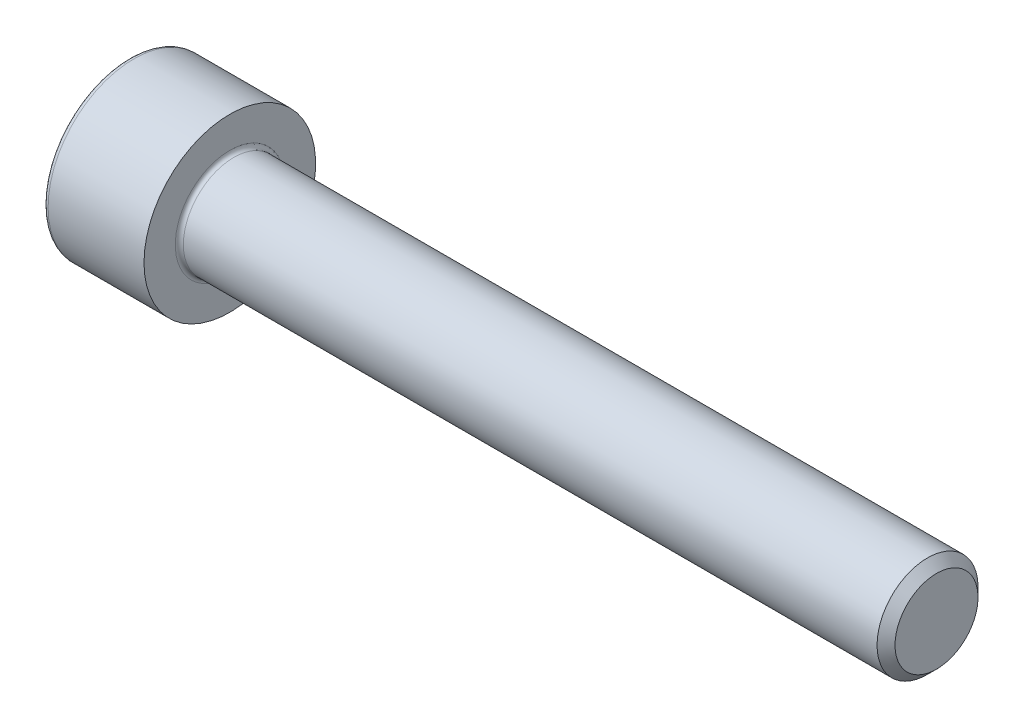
SolidWorks part; units mm, degrees
ref_plane "Plane1" through (0, 0, 0) normal (0, 0, 1) x (1, 0, 0)
ref_plane "Plane2" through (0, 0, 0) normal (0, 1, 0) x (1, 0, 0)
ref_plane "Plane3" through (0, 0, 0) normal (1, 0, 0) x (0, 0, -1)
sketch "BodySke" plane through (0, 0, 0) normal (0, 0, 1) x (1, 0, 0)
  line L0 (0, 0) -> (0, 4.25)
  line L1 (0, 4.25) -> (5, 4.25)
  line L2 (5, 4.25) -> (5, 2.5)
  line L3 (5, 2.5) -> (39.555, 2.5)
  line L4 (40, 2.055) -> (40, 0)
  line L5 (40, 0) -> (0, 0)
  line L6 (-31.75, 0) -> (127, 0) construction
  line L8 (40, 2.055) -> (39.555, 2.5)
  line L10 (40, -2.055) -> (39.555, -2.5) construction
  line L11 (5.8, 9.525) -> (5.8, 3.175) construction
  line L12 (18, 9.525) -> (18, 3.175) construction
  line L13 (-20, 9.525) -> (-20, 3.175) construction
  dimension "Diameter" = 5
  dimension "Head_ht" = 5
  dimension "Length" = 35
  dimension "Body_ch_ang" = 45
  dimension "Head_dia" = 8.5
  dimension "Minor_dia" = 4.11
  dimension "Advance" = 0.8
  dimension "Thread_nom" = 22
  dimension "Thread_length" = 60
revolve "Base-Revolve" add sketch "BodySke"
fillet "Fillet1" radius 0.2 1 edges at (5, 0, 2.5)
fillet "Fillet2" radius 0.25 1 edges at (0, 0, 4.25)
sketch "Sketch2" plane through (0, 0, 0) normal (0, 0, 1) x (1, 0, 0)
  line L0 (0, 2.042) -> (2.5, 2.042)
  line L1 (2.5, 2.042) -> (3.6789, 0)
  line L2 (-31.75, 0) -> (127, 0) construction
  line L3 (3.6789, 0) -> (0, 0)
  line L4 (0, 0) -> (0, 2.042)
  line L6 (0, 0) -> (47.625, 0) construction
  dimension "D1" = 2.042
  dimension "D2" = 60
  dimension "Depth" = 2.5
revolve "Hex-PreBroach" cut sketch "Sketch2" angle 360 about L6
sketch "Sketch3" plane through (0, 0, 0) normal (-1, 0, 0) x (0, 0.5, 0.866)
  line L0 (1.1789, 2.042) -> (-1.1789, 2.042)
  line L1 (-1.1789, 2.042) -> (-2.3579, 0)
  line L2 (1.1789, 2.042) -> (2.3579, 0)
  line L3 (1.1789, -2.042) -> (2.3579, 0)
  line L4 (1.1789, -2.042) -> (-1.1789, -2.042)
  line L5 (-1.1789, -2.042) -> (-2.3579, 0)
  dimension "D1" = 2.042
  dimension "D2" = 2.042
  dimension "Hex_size" = 4.084
extrude "Hex" cut sketch "Sketch3" against normal blind 2.5
sketch "ThdSchSke" plane through (0, 0, 0) normal (0, 0, 1) x (1, 0, 0)
  line L0 (18, -2.055) -> (17.6884, -2.5)
  line L1 (18, -2.055) -> (18.3116, -2.5)
  line L2 (18.3116, -2.5) -> (18.3116, -3.125)
  line L3 (-3.175, 0) -> (5.1513, 0) construction
  line L4 (0, 4) -> (0, -4) construction
  line L5 (18.3116, -3.125) -> (17.6884, -3.125)
  line L6 (17.6884, -3.125) -> (17.6884, -2.5)
  dimension "Thread_minor" = 4.11
  dimension "Diameter" = 5
  dimension "Start" = 18
  dimension "SideAngle" = 55
  dimension "VeeAngle" = 70
  dimension "Overcut" = 6.25
revolve "ThreadSchematic" [suppressed] cut sketch "ThdSchSke" angle 360 about L3
pattern_linear "ThdSchPat" [suppressed]
equation "\"D2@Sketch3\" = \"Hex_size@Sketch3\" / 2"
equation "\"D1@Sketch3\" = \"Hex_size@Sketch3\" / 2"
equation "\"D1@Sketch2\" = \"Hex_size@Sketch3\" / 2"
equation "\"Thread_minor@ThreadCosmetic\"  =  \"Minor_dia@BodySke\""
equation "\"Depth@Sketch2\" =  \"Key_eng@Hex\""
equation "\"Thread_length@ThreadCosmetic\" = ((sgn( (\"Length@BodySke\" - \"Advance@BodySke\" * 3.0) - \"Thread_nom@BodySke\" )-1)*( (\"Length@BodySke\" - \"Advance@BodySke\" * 3.0) - \"Thread_nom@BodySke\" ))/-2+ \"Thread_no"
equation "\"Thread_minor@ThdSchSke\" = \"Minor_dia@BodySke\""
equation "\"Diameter@ThdSchSke\" = \"Diameter@BodySke\""
equation "\"Overcut@ThdSchSke\" = \"Diameter@BodySke\" * 1.25"
equation "\"Start@ThdSchSke\" = \"Head_ht@BodySke\" + \"Length@BodySke\" - \"Thread_length@ThreadCosmetic\"  '---Non-countersunk---"
equation "\"Num_threads@ThdSchPat\" = int( \"Thread_length@ThreadCosmetic\" / \"Advance@BodySke\" + 0.999 )  + 1"
equation "\"Advance@ThdSchPat\" = \"Thread_length@ThreadCosmetic\" /  (\"Num_threads@ThdSchPat\" - 1) 'relax it"
equation "\"Num_threads@ThdSchPat\" = \"Num_threads@ThdSchPat\" - sgn( \"Num_threads@ThdSchPat\" - 1) '---chamfered tips only---"
